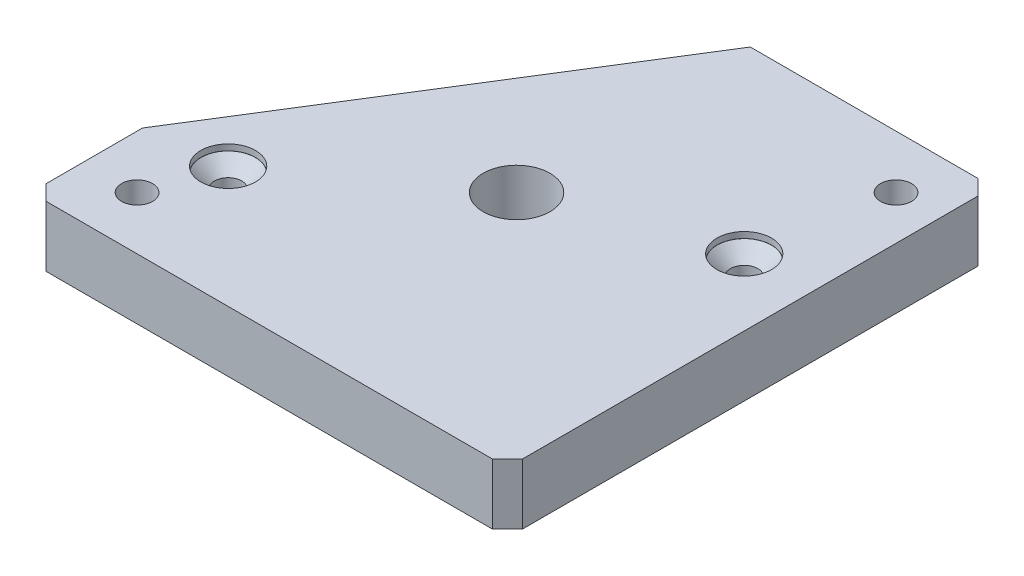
SolidWorks part; units mm, degrees
ref_plane "Plan de face" through (0, 0, 0) normal (0, 0, 1) x (1, 0, 0)
ref_plane "Plan de dessus" through (0, 0, 0) normal (0, 1, 0) x (1, 0, 0)
ref_plane "Plan de droite" through (0, 0, 0) normal (1, 0, 0) x (0, 0, -1)
sketch "Esquisse1" plane through (0, 0, 0) normal (0, 1, 0) x (1, 0, 0)
  line L1 (0, 0) -> (157, 0)
  line L2 (0, 0) -> (0, 160)
  line L3 (0, 160) -> (157, 160)
  line L4 (157, 0) -> (157, 160)
  dimension "D1" = 157
  dimension "D2" = 160
extrude "Extrusion1" add sketch "Esquisse1" along normal blind 20
other "Perçage1" parameters "D1"=20
sketch "Esquisse2" plane through (0, 20, 0) normal (0, 1, 0) x (-1, 0, 0)
  line L0 (-80, 0) -> (-80, -160) construction
  line L3 (0, 0) -> (-157, 0) construction
  line L4 (-157, -160) -> (0, -160) construction
  line L5 (0, -160) -> (0, 0) construction
  circle A0 centre (-80, -80) radius 11
  dimension "D1" = 22
  dimension "D2" = 80
hole_wizard "Trou taraudé M12x1.751" positions "Esquisse3D1" profile "Esquisse3" tap size "M12x1.75" standard "Ansi Métrique"
sketch3d "Esquisse3D1"
  line L0 (142.5, 20, -142.5) -> (17.5, 20, -142.5) construction
  line L3 (17.5, 20, -17.5) -> (17.5, 20, -142.5) construction
  line L4 (80, 20, -80) -> (17.5, 20, -80) construction
  line L5 (80, 0, -80) -> (80, 20, -80) construction
  line L6 (80, 20, -80) -> (80, 20, -142.5) construction
  point P0 (17.5, 20, -17.5)
  point P2 (142.5, 20, -142.5)
  dimension "D1" = 125
  dimension "D2" = 125
sketch "Esquisse3" plane through (17.5, 20, -17.5) normal (1, 0, 0) x (0, 0, 1)
  line L0 (0, 0) -> (0, 20)
  line L1 (0, 20) -> (5.1, 20)
  line L2 (5.1, 20) -> (5.1, 0)
  line L5 (5.1, 0) -> (0, 0)
  line L11 (0, -6.35) -> (0, 107.95) construction
  dimension "Diamètre du trou pour taraudage jusqu'au prochain" = 10.2
  dimension "Profondeur du trou pour taraudage jusqu'au prochain" = 20
chamfer "Chanfrein1" distance 5 angle 45 3 edges at (157, 10, 0) (0, 10, 0) (157, 10, -160)
sketch "Esquisse4" plane through (0, 20, 0) normal (0, 1, 0) x (-1, 0, 0)
  circle A0 centre (-135, -100) radius 9
  circle A1 centre (-25, -40) radius 9
  circle A2 centre (-80, -80) radius 11 construction
  dimension "D1" = 18
  dimension "D2" = 110
  dimension "D3" = 55
  dimension "D4" = 60
  dimension "D5" = 20
extrude "Enlèv. mat.-Extru.1" cut sketch "Esquisse4" against normal blind 2
hole_wizard "Fraisage pour vis à tête fraisée à 6 pans creux M82" positions "Esquisse3D3" profile "Esquisse6" countersink size "M8" standard "ISO"
sketch3d "Esquisse3D3"
  line L0 (135, 18, -100) -> (135, 20, -100) construction
  line L1 (25, 18, -40) -> (25, 20, -40) construction
  point P0 (135, 18, -100)
  point P4 (25, 18, -40)
sketch "Esquisse6" plane through (135, 18, -100) normal (1, 0, 0) x (0, 0, 1)
  line L0 (0, 0) -> (0, 18)
  line L1 (0, 18) -> (4.5, 18)
  line L2 (4.5, 18) -> (4.5, 4.46)
  line L3 (4.5, 4.46) -> (8.96, 0)
  line L5 (8.96, 0) -> (0, 0)
  line L6 (-4.5, 4.46) -> (-8.96, 0) construction
  line L11 (0, -6.35) -> (0, 107.95) construction
  dimension "Diamètre du perçage jusqu'au prochain" = 9
  dimension "Profondeur du perçage jusqu'au prochain" = 18
  dimension "Diamètre du fraisage entrant" = 17.92
  dimension "Angle du fraisage entrant" = 90
sketch "Esquisse8" plane through (0, 0, 0) normal (0, -1, 0) x (1, 0, 0)
  line L0 (0, -160) -> (0, -5) construction
  line L1 (0, -36.7742) -> (77, -160)
  line L2 (152, -160) -> (0, -160) construction
  line L3 (77, -160) -> (0, -160)
  line L4 (0, -160) -> (0, -36.7742)
  line L5 (157, -5) -> (157, -155) construction
  dimension "D1" = 32
  dimension "D2" = 80
extrude "Enlèv. mat.-Extru.2" cut sketch "Esquisse8" against normal through all
